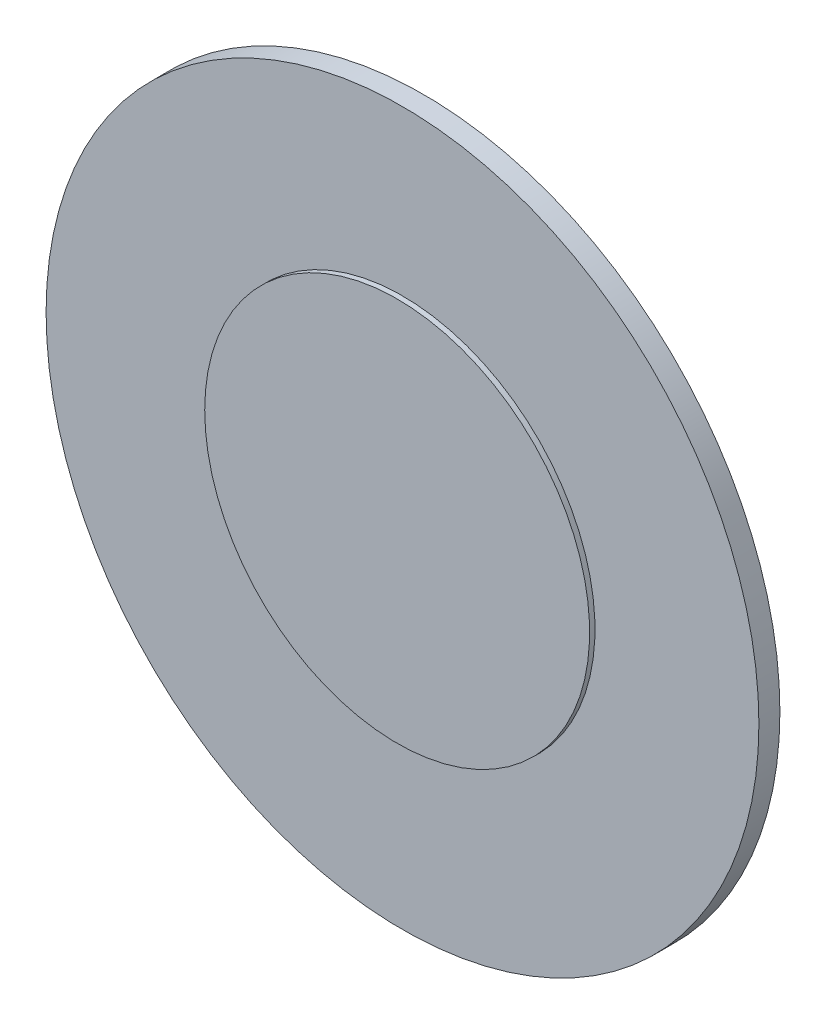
SolidWorks part; units mm, degrees
ref_plane "Front Plane" through (0, 0, 0) normal (0, 0, 1) x (1, 0, 0)
ref_plane "Top Plane" through (0, 0, 0) normal (0, 1, 0) x (1, 0, 0)
ref_plane "Right Plane" through (0, 0, 0) normal (1, 0, 0) x (0, 0, -1)
sketch "Sketch1" plane through (0, 0, 0) normal (0, 0, 1) x (1, 0, 0)
  circle A0 centre (0, 0) radius 5.0927
  dimension "D1" = 10.1854
extrude "outer" add sketch "Sketch1" along normal blind 0.3
sketch "Sketch2" plane through (0, 0, 0.3) normal (0, 0, 1) x (1, 0, 0)
  circle A0 centre (0, 0) radius 2.75
  dimension "D1" = 5.5
extrude "inner" add sketch "Sketch2" along normal blind 0.0762
